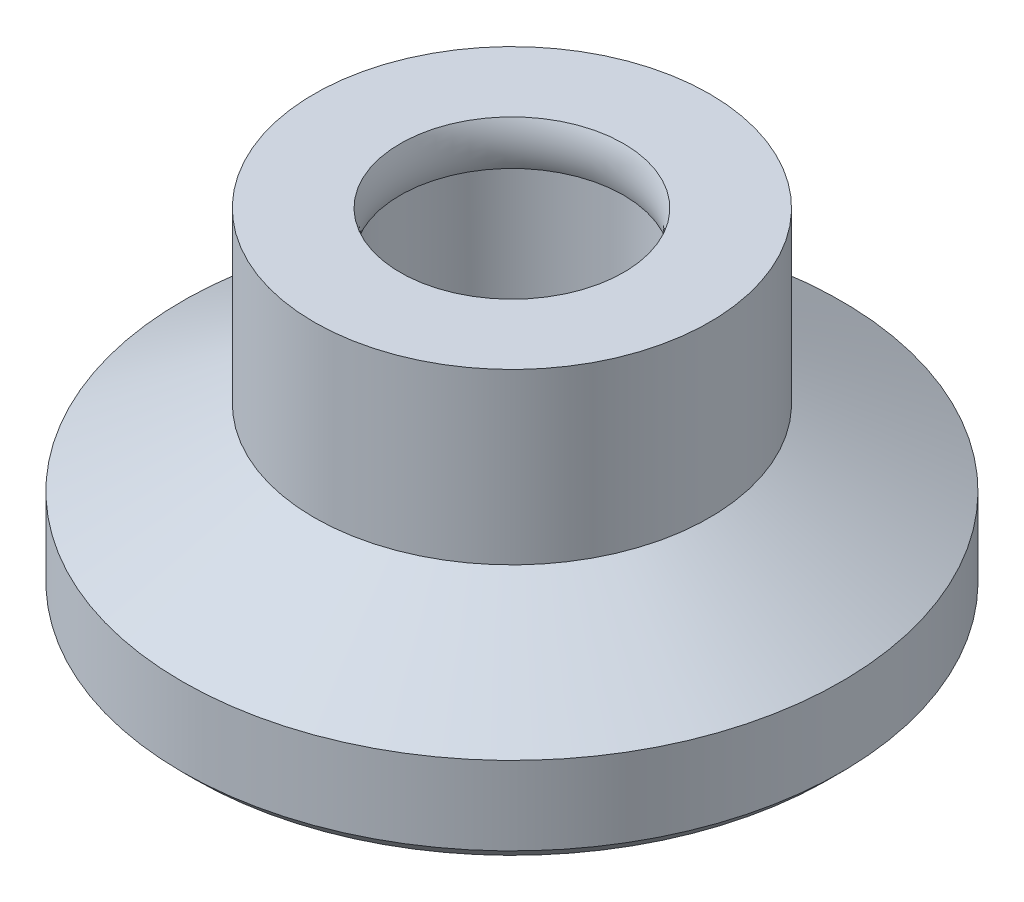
SolidWorks part; units mm, degrees
ref_plane "Front Plane" through (0, 0, 0) normal (0, 0, 1) x (1, 0, 0)
ref_plane "Top Plane" through (0, 0, 0) normal (0, 1, 0) x (1, 0, 0)
ref_plane "Right Plane" through (0, 0, 0) normal (1, 0, 0) x (0, 0, -1)
sketch "Sketch1" plane through (0, 0, 0) normal (0, 1, 0) x (1, 0, 0)
  circle A0 centre (0, 0) radius 5.4
  dimension "D1" = 10.8
extrude "Extrude1" add sketch "Sketch1" along normal mid plane 9.2
sketch "Sketch3" plane through (0, -4.6, 0) normal (0, -1, 0) x (1, 0, 0)
  circle A0 centre (0, 0) radius 9
  dimension "D1" = 18
extrude "Extrude2" add sketch "Sketch3" against normal blind 2.5
sketch "Sketch4" plane through (0, 0, 0) normal (0, 0, 1) x (1, 0, 0)
  line L0 (-9, -2.1) -> (-5.4, -0.0215)
  line L1 (-5.4, 4.6) -> (-5.4, -2.1) construction
  line L2 (-5.4, -0.0215) -> (-5.4, -2.1)
  line L3 (-5.4, -2.1) -> (-9, -2.1)
  dimension "D1" = 30
revolve "Revolve1" add sketch "Sketch4" angle 360 about axis through (0, 4.6, 0) along (0, -1, 0)
chamfer "Chamfer1" distance 0.36 angle 45 1 edges at (0, -4.6, -9)
sketch "Sketch5" plane through (0, 0, 0) normal (0, 0, 1) x (1, 0, 0)
  line L1 (0, 0) -> (0, 11.3083) construction
  line L2 (0, 4.6) -> (3.05, 4.6)
  line L3 (5.4, 4.6) -> (-5.4, 4.6) construction
  line L4 (3.05, 3.38) -> (3.05, -0.3391)
  line L5 (3.05, -0.3391) -> (0, -2.1)
  line L6 (0, -2.1) -> (0, 4.6)
  line L7 (9, -2.1) -> (-9, -2.1) construction
  arc A0 (3.05, 4.6) -> (3.05, 3.38) centre (4.514, 3.99) ccw
  point P14 (2.928, 3.99)
  dimension "D2" = 6.1
  dimension "D1" = 60
  dimension "D3" = 1.22
  dimension "D4" = 0.122
revolve "Cut-Revolve1" cut sketch "Sketch5" angle 360 about L1
equation "\"D3@Sketch5\" = \"D2@Sketch5\"*0.2"
equation "\"D4@Sketch5\" = \"D3@Sketch5\"*0.1"
